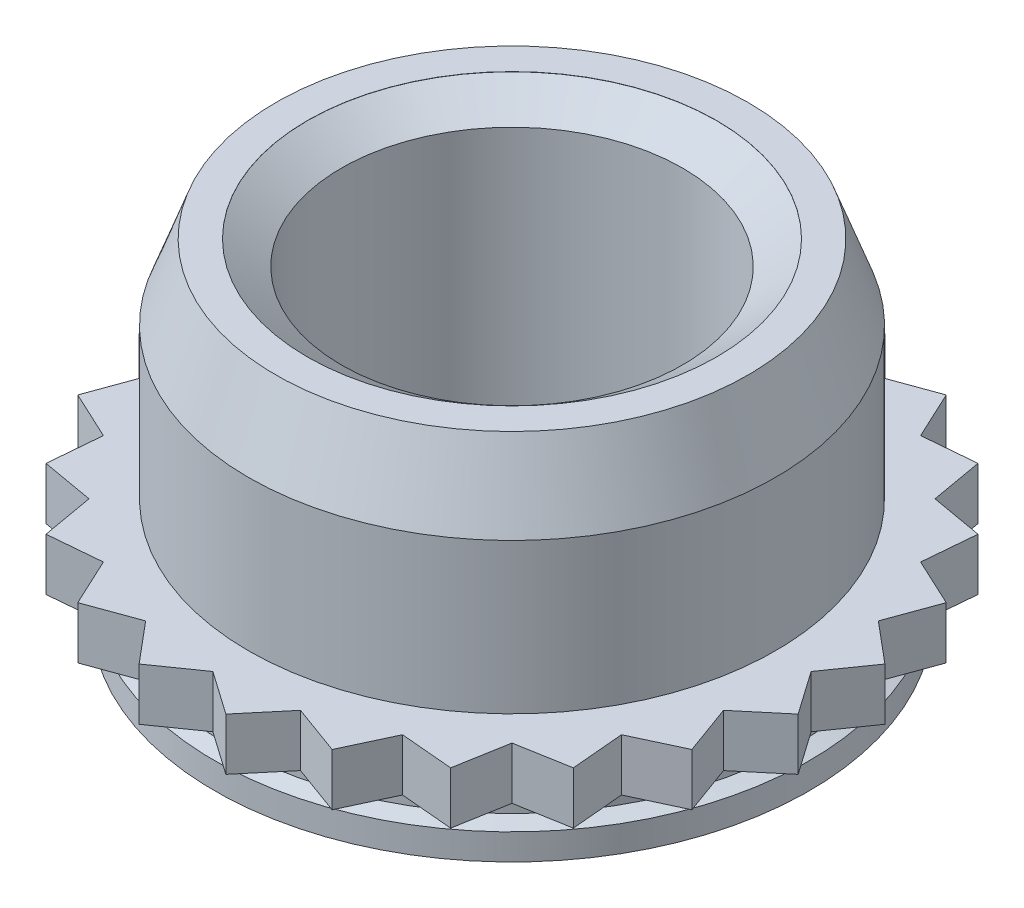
SolidWorks part; units mm, degrees
ref_plane "Plane1" through (0, 0, 0) normal (0, 0, 1) x (1, 0, 0)
ref_plane "Plane2" through (0, 0, 0) normal (0, 1, 0) x (1, 0, 0)
ref_plane "Plane3" through (0, 0, 0) normal (1, 0, 0) x (0, 0, -1)
sketch "BodySke" plane through (0, 0, 0) normal (0, 0, 1) x (1, 0, 0)
  line L0 (4.1372, -1.0682) -> (4.1372, -0.765)
  line L1 (3.86, 2.2) -> (3.4596, 3.3)
  line L2 (4.87, 0) -> (3.86, 0)
  line L3 (2.5, 3.3) -> (2.5, -1.53)
  line L4 (2.5, -1.53) -> (4.355, -1.53)
  line L5 (4.355, -1.53) -> (4.355, -1.1475)
  line L6 (4.355, -1.1475) -> (4.1372, -1.0682)
  line L7 (1.016, 1) -> (3.86, 1) construction
  line L8 (3.86, 0) -> (3.86, 2.2)
  line L9 (0, 0) -> (0, 15.24) construction
  line L11 (3.4596, 3.3) -> (2.5, 3.3)
  line L15 (4.1372, -0.765) -> (4.87, -0.765)
  line L16 (4.87, -0.765) -> (4.87, 0)
  dimension "D1" = 20
  dimension "D2" = 70
  dimension "C_dia" = 8.71
  dimension "A_ht" = 1.53
  dimension "Thread_min" = 5
  dimension "Clinch_dia" = 9.74
  dimension "C_len" = 0.3825
  dimension "Clinching_ht" = 0.765
  dimension "Advance" = 1
  dimension "D_dia" = 7.72
  dimension "Height" = 3.3
  dimension "Groove_dia" = 8.2745
  dimension "Chamfer_ht" = 1.1
revolve "Body" add sketch "BodySke"
revolve "EndChamfer" cut sketch "EndChamferSke" angle 360 about L0
sketch "EndChamferSke" plane through (0, 0, 0) normal (0, 0, 1) x (1, 0, 0)
  line L0 (0, -2.54) -> (0, 7.62) construction
  line L1 (0, 0) -> (0, 15.24) construction
  line L2 (3, -1.784) -> (3, -1.5275)
  line L3 (3, -1.5275) -> (2.5, -1.1775)
  line L4 (2.5, -1.1775) -> (2.5, -1.784)
  line L5 (2.5, -1.784) -> (3, -1.784)
  line L6 (3, 3.2975) -> (3, 3.554)
  line L7 (3, 3.554) -> (2.5, 3.554)
  line L8 (2.5, 3.554) -> (2.5, 2.9475)
  line L9 (2.5, 2.9475) -> (3, 3.2975)
  line L10 (3.4596, 3.3) -> (-3.4596, 3.3) construction
  line L11 (-4.355, -1.53) -> (4.355, -1.53) construction
  line L12 (2.5, 3.3) -> (-2.5, 3.3) construction
  dimension "D1" = 0.254
  dimension "Thread_nominal" = 6
  dimension "D2" = 34.99
  dimension "D3" = 0.254
  dimension "Thread_min" = 5
  dimension "Inset" = 0.0025
  dimension "Inset_far" = 0.0025
ref_plane "Plane4" through (0, -0.5486, 0) normal (0, 1, 0) x (-1, 0, 0)
sketch "ThdSchSke" plane through (0, 0, 0) normal (0, 0, 1) x (1, 0, 0)
  line L0 (0, -5.08) -> (0, 7.62) construction
  line L1 (0, 0) -> (0, 15.24) construction
  line L2 (0, -1.5275) -> (3, -1.5275) construction
  line L4 (3, -1.5275) -> (2.5, -1.1774)
  line L6 (3, -1.5275) -> (2.5, -1.8776)
  line L7 (2.5, -1.1774) -> (2.5, -1.8776)
  line L8 (3, -1.5275) -> (-3, -1.5275) construction
  dimension "Vee_angle" = 70
  dimension "Thread_nominal" = 6
  dimension "Thread_min" = 5
revolve "ThreadSchematic" [suppressed] cut sketch "ThdSchSke" angle 360 about L0
pattern_linear "ThdSchPat" [suppressed]
sketch "CliRinCutSke" plane through (0, -0.765, 0) normal (0, -1, 0) x (1, 0, 0)
  line L0 (0.6357, 4.8283) -> (0, 4.383)
  line L1 (0, 4.383) -> (-0.6357, 4.8283)
  line L2 (0, 0) -> (0, 5.842) construction
  arc A1 (0.6357, 4.8283) -> (-0.6357, 4.8283) centre (0, 0) ccw
  circle A2 centre (0, 0) radius 4.383 construction
  dimension "Clinch_dia" = 9.74
  dimension "Clinch_minor" = 8.766
  dimension "Angle" = 15
extrude "ClinchCut" cut sketch "CliRinCutSke" against normal blind 0.765
pattern_circular "ClinchCutPat" count 24 every 15 about axis through (0, 0, 0) along (0, 1, 0) of "ClinchCut"
equation "' \"A_ht@BodySke\" = 1.53"
equation "' \"D_dia@BodySke\" = 7.72"
equation "' \"C_dia@BodySke\" = 8.71"
equation "' \"Height@BodySke\" = 3.3"
equation "' \"Clinch_dia@BodySke\" = 9.74"
equation "' \"Advance@BodySke\" = 1"
equation "' \"Thread_min@BodySke\" = 5"
equation "' \"Thread_nominal@ThreadCosmetic\" = 6"
equation "\"Count@ClinchCutPat\" = 24"
equation "\"Angle@ClinchCutPat\" = 360 / \"Count@ClinchCutPat\""
equation "\"Angle@CliRinCutSke\" = 360 / \"Count@ClinchCutPat\""
equation "\"Clinch_dia@CliRinCutSke\" = \"Clinch_dia@BodySke\""
equation "\"Clinch_minor@CliRinCutSke\" = \"Clinch_dia@BodySke\" * 0.9"
equation "\"C_len@BodySke\" = \"A_ht@BodySke\" * 0.25"
equation "\"Groove_dia@BodySke\" = \"C_dia@BodySke\" * 0.95"
equation "\"Clinching_ht@BodySke\" = \"A_ht@BodySke\" * 0.5"
equation "\"Depth@ClinchCut\" =  \"A_ht@BodySke\" * 0.5"
equation "\"Chamfer_ht@BodySke\" = \"Height@BodySke\" / 3"
equation "\"Thread_nominal@EndChamferSke\" = \"Thread_nominal@ThreadCosmetic\""
equation "\"Thread_min@EndChamferSke\" = \"Thread_min@BodySke\""
equation "\"D2@EndChamferSke\" = \"Vee_angle@ThdSchSke\" / 2 - 0.01"
equation "\"Thread_nominal@ThdSchSke\" = \"Thread_nominal@ThreadCosmetic\""
equation "\"Thread_min@ThdSchSke\" = \"Thread_min@BodySke\""
equation "\"Num_threads@ThdSchPat\" = int(  ( \"Height@BodySke\" + \"A_ht@BodySke\" - \"Inset@EndChamferSke\" - \"Inset_far@EndChamferSke\" ) / \"Advance@BodySke\" + 0.999 )  + 1"
equation "\"Advance@ThdSchPat\" = ( \"Height@BodySke\" + \"A_ht@BodySke\" - \"Inset@EndChamferSke\" - \"Inset_far@EndChamferSke\" ) /  (\"Num_threads@ThdSchPat\" - 1) 'relax it"
